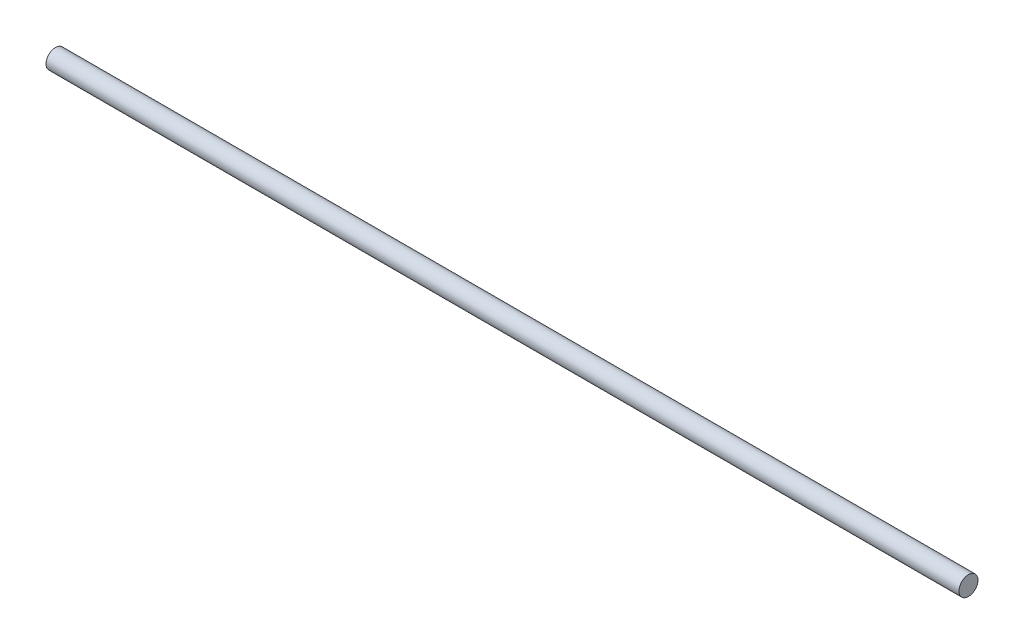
SolidWorks part; units mm, degrees
ref_plane "Front" through (0, 0, 0) normal (0, 0, 1) x (1, 0, 0)
ref_plane "Top" through (0, 0, 0) normal (0, 1, 0) x (1, 0, 0)
ref_plane "Right" through (0, 0, 0) normal (1, 0, 0) x (0, 0, -1)
sketch "Sketch2" plane through (0, 0, 0) normal (0, 0, 1) x (1, 0, 0)
  line L2 (0, 0) -> (-227.1092, 0) construction
  line L4 (0, 9.525) -> (-914.4, 9.525) construction
  line L8 (0, 9.525) -> (-914.4, 9.525)
  line L9 (-914.4, 0) -> (-914.4, 9.525) construction
  line L10 (-914.4, 0) -> (-914.4, 9.525)
  line L11 (0, 0) -> (0, 33.401) construction
  line L12 (0, 0) -> (0, 9.525)
  line L13 (-914.4, 0) -> (0, 0)
revolve "Base-Revolve" add sketch "Sketch2" angle 360 about L2
